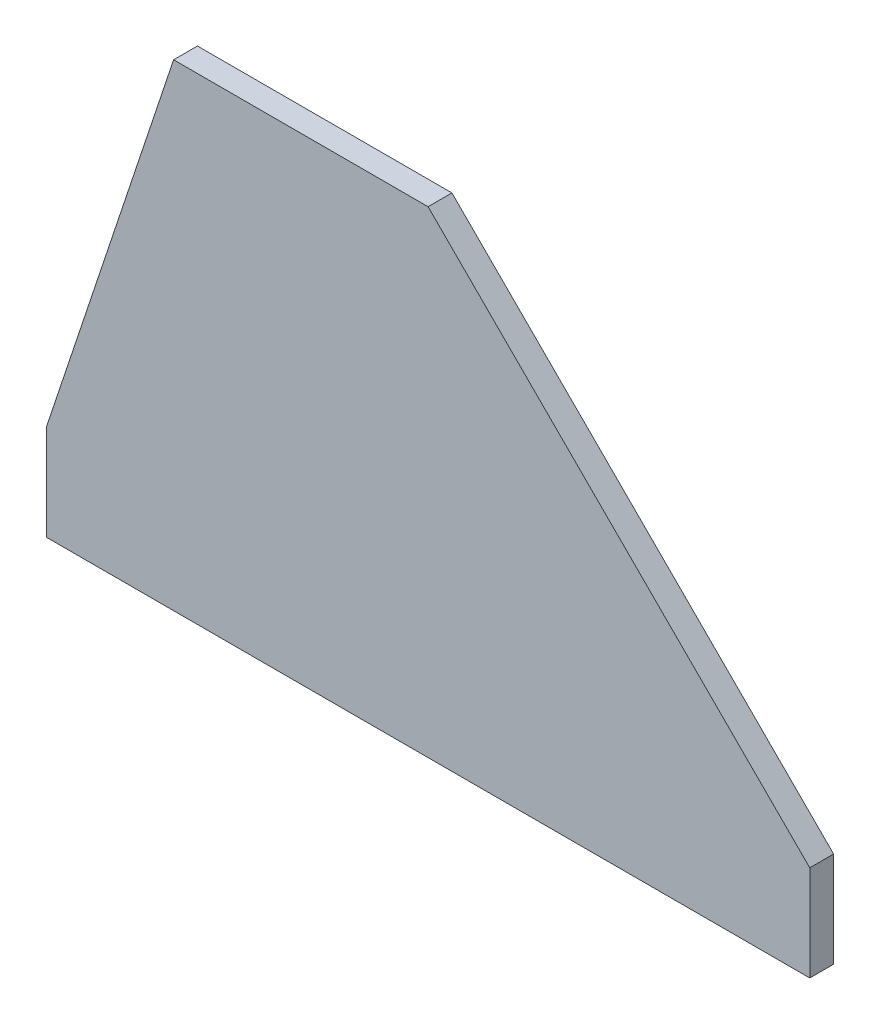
SolidWorks part; units mm, degrees
ref_plane "Front Plane" through (0, 0, 0) normal (0, 0, 1) x (1, 0, 0)
ref_plane "Top Plane" through (0, 0, 0) normal (0, 1, 0) x (1, 0, 0)
ref_plane "Right Plane" through (0, 0, 0) normal (1, 0, 0) x (0, 0, -1)
sketch "Sketch1" plane through (0, 0, 0) normal (0, 0, 1) x (1, 0, 0)
  line L1 (152.4, 0) -> (76.2, 76.2)
  line L2 (76.2, 76.2) -> (25.4, 76.2)
  line L3 (25.4, 76.2) -> (0, 0)
  line L4 (152.4, 0) -> (152.4, -19.05)
  line L5 (152.4, -19.05) -> (0, -19.05)
  line L6 (0, -19.05) -> (0, 0)
  dimension "D1" = 152.4
  dimension "D2" = 76.2
  dimension "D3" = 76.2
  dimension "D4" = 25.4
  dimension "D5" = 19.05
  dimension "D6" = 76.2
extrude "Extrude1" add sketch "Sketch1" along normal blind 4.7625
